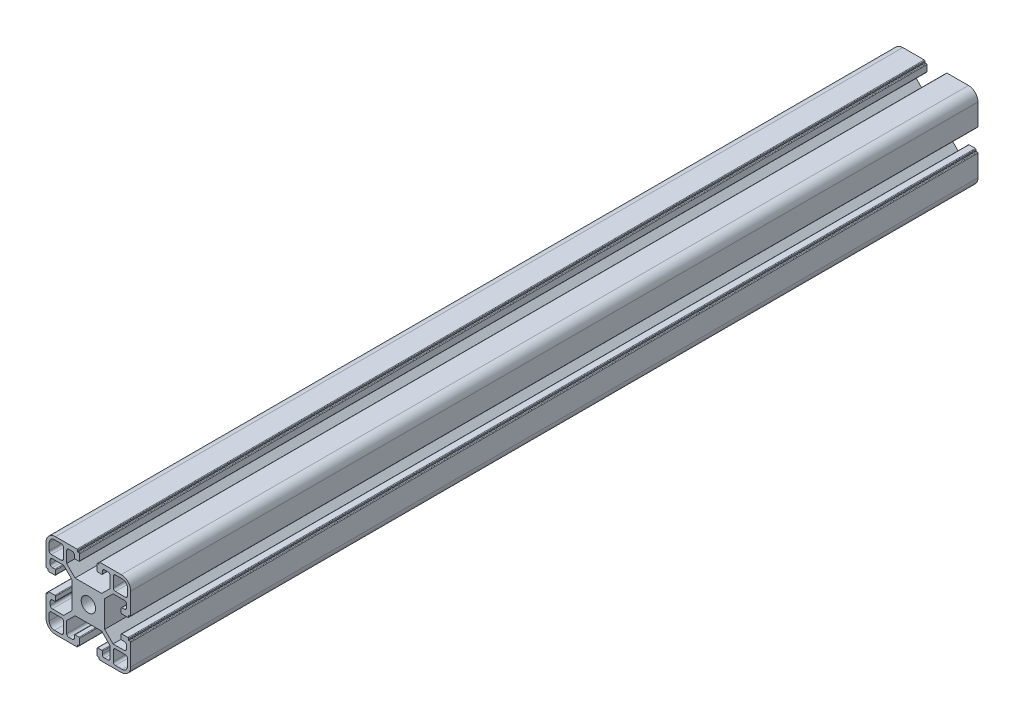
SolidWorks part; units mm, degrees
ref_plane "Plan de face" through (0, 0, 0) normal (0, 0, 1) x (1, 0, 0)
ref_plane "Plan de dessus" through (0, 0, 0) normal (0, 1, 0) x (1, 0, 0)
ref_plane "Plan de droite" through (0, 0, 0) normal (1, 0, 0) x (0, 0, -1)
sketch "Esquisse1" plane through (0, 0, 0) normal (0, 0, 1) x (1, 0, 0)
  line L0 (-4.2483, 11.6297) -> (-8.9983, 11.6297)
  line L1 (-9.9983, 12.6297) -> (-9.9983, 15.8797)
  line L2 (-7.4983, 18.3797) -> (-4.2483, 18.3797)
  line L3 (-3.2483, 17.3797) -> (-3.2483, 12.6297)
  line L4 (21.2517, -11.8703) -> (26.0017, -11.8703)
  line L5 (27.0017, -12.8703) -> (27.0017, -16.1203)
  line L6 (24.5017, -18.6203) -> (21.2517, -18.6203)
  line L7 (20.2517, -17.6203) -> (20.2517, -12.8703)
  line L8 (-3.2483, -12.8703) -> (-3.2483, -17.6203)
  line L9 (-4.2483, -18.6203) -> (-7.4983, -18.6203)
  line L10 (-9.9983, -16.1203) -> (-9.9983, -12.8703)
  line L11 (-8.9983, -11.8703) -> (-4.2483, -11.8703)
  line L12 (27.0017, 15.8797) -> (27.0017, 12.6297)
  line L13 (26.0017, 11.6297) -> (21.2553, 11.6297)
  line L14 (20.2517, 12.6297) -> (20.2517, 17.3797)
  line L15 (21.2517, 18.3797) -> (24.5017, 18.3797)
  line L16 (0.8017, -6.4061) -> (0.8017, 6.1654)
  line L17 (0.8017, -6.4061) -> (-3.1625, -10.3703)
  line L18 (-8.4983, -10.3703) -> (-3.1625, -10.3703)
  line L19 (-9.4983, -7.7203) -> (-9.4983, -9.3703)
  line L20 (-8.4983, -6.7203) -> (-7.2983, -6.7203)
  line L21 (-6.9983, -4.5203) -> (-6.9983, -6.4203)
  line L22 (-10.1983, -4.2203) -> (-7.2983, -4.2203)
  line L23 (-10.4983, -4.5203) -> (-10.4983, -5.0203)
  line L24 (-11.1983, -5.2203) -> (-10.6983, -5.2203)
  line L25 (-11.4983, -5.5203) -> (-11.4983, -15.6203)
  line L26 (-6.9983, -20.1203) -> (3.1017, -20.1203)
  line L27 (3.4017, -19.8203) -> (3.4017, -19.3203)
  line L28 (3.6017, -19.1203) -> (4.1017, -19.1203)
  line L29 (4.4017, -18.8203) -> (4.4017, -15.9203)
  line L30 (2.2017, -15.6203) -> (4.1017, -15.6203)
  line L31 (1.9017, -17.1203) -> (1.9017, -15.9203)
  line L32 (-0.7483, -18.1203) -> (0.9017, -18.1203)
  line L33 (-1.7483, -17.1203) -> (-1.7483, -11.7846)
  line L34 (2.2159, -7.8203) -> (-1.7483, -11.7846)
  line L35 (14.7875, -7.8203) -> (2.2159, -7.8203)
  line L36 (14.7875, -7.8203) -> (18.7517, -11.7846)
  line L37 (18.7517, -17.1203) -> (18.7517, -11.7846)
  line L38 (16.1017, -18.1203) -> (17.7517, -18.1203)
  line L39 (15.1017, -17.1203) -> (15.1017, -15.9203)
  line L40 (12.9017, -15.6203) -> (14.8017, -15.6203)
  line L41 (12.6017, -18.8203) -> (12.6017, -15.9203)
  line L42 (12.9017, -19.1203) -> (13.4017, -19.1203)
  line L43 (13.6017, -19.8203) -> (13.6017, -19.3203)
  line L44 (13.9017, -20.1203) -> (24.0017, -20.1203)
  line L45 (28.5017, -15.6203) -> (28.5017, -5.5203)
  line L46 (28.2017, -5.2203) -> (27.7017, -5.2203)
  line L47 (27.5017, -5.0203) -> (27.5017, -4.5203)
  line L48 (27.2017, -4.2203) -> (24.3017, -4.2203)
  line L49 (24.0017, -6.4203) -> (24.0017, -4.5203)
  line L50 (25.5017, -6.7203) -> (24.3017, -6.7203)
  line L51 (26.5017, -9.3703) -> (26.5017, -7.7203)
  line L52 (25.5017, -10.3703) -> (20.1659, -10.3703)
  line L53 (16.2017, -6.4061) -> (20.1659, -10.3703)
  line L54 (16.2017, 6.1654) -> (16.2017, -6.4061)
  line L55 (16.2017, 6.1654) -> (20.1659, 10.1297)
  line L56 (25.5017, 10.1297) -> (20.1659, 10.1297)
  line L57 (26.5017, 7.4797) -> (26.5017, 9.1297)
  line L58 (25.5017, 6.4797) -> (24.3017, 6.4797)
  line L59 (24.0017, 4.2797) -> (24.0017, 6.1797)
  line L60 (27.2017, 3.9797) -> (24.3017, 3.9797)
  line L61 (27.5017, 4.2797) -> (27.5017, 4.7797)
  line L62 (28.2017, 4.9797) -> (27.7017, 4.9797)
  line L63 (28.5017, 5.2797) -> (28.5017, 15.3797)
  line L64 (24.0017, 19.8797) -> (13.9017, 19.8797)
  line L65 (13.6017, 19.5797) -> (13.6017, 19.0797)
  line L66 (13.4017, 18.8797) -> (12.9017, 18.8797)
  line L67 (12.6017, 18.5797) -> (12.6017, 15.6797)
  line L68 (14.8017, 15.3797) -> (12.9017, 15.3797)
  line L69 (15.1017, 16.8797) -> (15.1017, 15.6797)
  line L70 (17.7517, 17.8797) -> (16.1017, 17.8797)
  line L71 (18.7517, 16.8797) -> (18.7517, 11.5439)
  line L72 (14.7875, 7.5797) -> (18.7517, 11.5439)
  line L73 (2.2159, 7.5797) -> (14.7875, 7.5797)
  line L74 (2.2159, 7.5797) -> (-1.7483, 11.5439)
  line L75 (-1.7483, 16.8797) -> (-1.7483, 11.5439)
  line L76 (0.9017, 17.8797) -> (-0.7483, 17.8797)
  line L77 (1.9017, 16.8797) -> (1.9017, 15.6797)
  line L78 (4.1017, 15.3797) -> (2.2017, 15.3797)
  line L79 (4.4017, 18.5797) -> (4.4017, 15.6797)
  line L80 (4.1017, 18.8797) -> (3.6017, 18.8797)
  line L81 (3.4017, 19.5797) -> (3.4017, 19.0797)
  line L82 (3.1017, 19.8797) -> (-6.9983, 19.8797)
  line L83 (-11.4983, 15.3797) -> (-11.4983, 5.2797)
  line L84 (-11.1983, 4.9797) -> (-10.6983, 4.9797)
  line L85 (-10.4983, 4.7797) -> (-10.4983, 4.2797)
  line L86 (-10.1983, 3.9797) -> (-7.2983, 3.9797)
  line L87 (-6.9983, 6.1797) -> (-6.9983, 4.2797)
  line L88 (-8.4983, 6.4797) -> (-7.2983, 6.4797)
  line L89 (-9.4983, 9.1297) -> (-9.4983, 7.4797)
  line L90 (-8.4983, 10.1297) -> (-3.1625, 10.1297)
  line L91 (0.8017, 6.1654) -> (-3.1625, 10.1297)
  line L92 (21.2553, 11.6297) -> (21.2517, 11.6297)
  arc A0 (-4.2483, 11.6297) -> (-3.2483, 12.6297) centre (-4.2483, 12.6297) ccw
  arc A1 (-9.9983, 12.6297) -> (-8.9983, 11.6297) centre (-8.9983, 12.6297) ccw
  arc A2 (-7.4983, 18.3797) -> (-9.9983, 15.8797) centre (-7.4983, 15.8797) ccw
  arc A3 (-3.2483, 17.3797) -> (-4.2483, 18.3797) centre (-4.2483, 17.3797) ccw
  arc A4 (21.2517, -11.8703) -> (20.2517, -12.8703) centre (21.2517, -12.8703) ccw
  arc A5 (27.0017, -12.8703) -> (26.0017, -11.8703) centre (26.0017, -12.8703) ccw
  arc A6 (24.5017, -18.6203) -> (27.0017, -16.1203) centre (24.5017, -16.1203) ccw
  arc A7 (20.2517, -17.6203) -> (21.2517, -18.6203) centre (21.2517, -17.6203) ccw
  arc A8 (-3.2483, -12.8703) -> (-4.2483, -11.8703) centre (-4.2483, -12.8703) ccw
  arc A9 (-4.2483, -18.6203) -> (-3.2483, -17.6203) centre (-4.2483, -17.6203) ccw
  arc A10 (-9.9983, -16.1203) -> (-7.4983, -18.6203) centre (-7.4983, -16.1203) ccw
  arc A11 (-8.9983, -11.8703) -> (-9.9983, -12.8703) centre (-8.9983, -12.8703) ccw
  circle A12 centre (8.5017, -0.1203) radius 3.4
  arc A13 (27.0017, 15.8797) -> (24.5017, 18.3797) centre (24.5017, 15.8797) ccw
  arc A14 (26.0017, 11.6297) -> (27.0017, 12.6297) centre (26.0017, 12.6297) ccw
  arc A15 (20.2517, 12.6297) -> (21.2517, 11.6297) centre (21.2517, 12.6297) ccw
  arc A16 (21.2517, 18.3797) -> (20.2517, 17.3797) centre (21.2517, 17.3797) ccw
  arc A17 (-9.4983, -9.3703) -> (-8.4983, -10.3703) centre (-8.4983, -9.3703) ccw
  arc A18 (-8.4983, -6.7203) -> (-9.4983, -7.7203) centre (-8.4983, -7.7203) ccw
  arc A19 (-7.2983, -6.7203) -> (-6.9983, -6.4203) centre (-7.2983, -6.4203) ccw
  arc A20 (-6.9983, -4.5203) -> (-7.2983, -4.2203) centre (-7.2983, -4.5203) ccw
  arc A21 (-10.1983, -4.2203) -> (-10.4983, -4.5203) centre (-10.1983, -4.5203) ccw
  arc A22 (-10.6983, -5.2203) -> (-10.4983, -5.0203) centre (-10.6983, -5.0203) ccw
  arc A23 (-11.1983, -5.2203) -> (-11.4983, -5.5203) centre (-11.1983, -5.5203) ccw
  arc A24 (-11.4983, -15.6203) -> (-6.9983, -20.1203) centre (-6.9983, -15.6203) ccw
  arc A25 (3.1017, -20.1203) -> (3.4017, -19.8203) centre (3.1017, -19.8203) ccw
  arc A26 (3.6017, -19.1203) -> (3.4017, -19.3203) centre (3.6017, -19.3203) ccw
  arc A27 (4.1017, -19.1203) -> (4.4017, -18.8203) centre (4.1017, -18.8203) ccw
  arc A28 (4.4017, -15.9203) -> (4.1017, -15.6203) centre (4.1017, -15.9203) ccw
  arc A29 (2.2017, -15.6203) -> (1.9017, -15.9203) centre (2.2017, -15.9203) ccw
  arc A30 (0.9017, -18.1203) -> (1.9017, -17.1203) centre (0.9017, -17.1203) ccw
  arc A31 (-1.7483, -17.1203) -> (-0.7483, -18.1203) centre (-0.7483, -17.1203) ccw
  arc A32 (17.7517, -18.1203) -> (18.7517, -17.1203) centre (17.7517, -17.1203) ccw
  arc A33 (15.1017, -17.1203) -> (16.1017, -18.1203) centre (16.1017, -17.1203) ccw
  arc A34 (15.1017, -15.9203) -> (14.8017, -15.6203) centre (14.8017, -15.9203) ccw
  arc A35 (12.9017, -15.6203) -> (12.6017, -15.9203) centre (12.9017, -15.9203) ccw
  arc A36 (12.6017, -18.8203) -> (12.9017, -19.1203) centre (12.9017, -18.8203) ccw
  arc A37 (13.6017, -19.3203) -> (13.4017, -19.1203) centre (13.4017, -19.3203) ccw
  arc A38 (13.6017, -19.8203) -> (13.9017, -20.1203) centre (13.9017, -19.8203) ccw
  arc A39 (24.0017, -20.1203) -> (28.5017, -15.6203) centre (24.0017, -15.6203) ccw
  arc A40 (28.5017, -5.5203) -> (28.2017, -5.2203) centre (28.2017, -5.5203) ccw
  arc A41 (27.5017, -5.0203) -> (27.7017, -5.2203) centre (27.7017, -5.0203) ccw
  arc A42 (27.5017, -4.5203) -> (27.2017, -4.2203) centre (27.2017, -4.5203) ccw
  arc A43 (24.3017, -4.2203) -> (24.0017, -4.5203) centre (24.3017, -4.5203) ccw
  arc A44 (24.0017, -6.4203) -> (24.3017, -6.7203) centre (24.3017, -6.4203) ccw
  arc A45 (26.5017, -7.7203) -> (25.5017, -6.7203) centre (25.5017, -7.7203) ccw
  arc A46 (25.5017, -10.3703) -> (26.5017, -9.3703) centre (25.5017, -9.3703) ccw
  arc A47 (26.5017, 9.1297) -> (25.5017, 10.1297) centre (25.5017, 9.1297) ccw
  arc A48 (25.5017, 6.4797) -> (26.5017, 7.4797) centre (25.5017, 7.4797) ccw
  arc A49 (24.3017, 6.4797) -> (24.0017, 6.1797) centre (24.3017, 6.1797) ccw
  arc A50 (24.0017, 4.2797) -> (24.3017, 3.9797) centre (24.3017, 4.2797) ccw
  arc A51 (27.2017, 3.9797) -> (27.5017, 4.2797) centre (27.2017, 4.2797) ccw
  arc A52 (27.7017, 4.9797) -> (27.5017, 4.7797) centre (27.7017, 4.7797) ccw
  arc A53 (28.2017, 4.9797) -> (28.5017, 5.2797) centre (28.2017, 5.2797) ccw
  arc A54 (28.5017, 15.3797) -> (24.0017, 19.8797) centre (24.0017, 15.3797) ccw
  arc A55 (13.9017, 19.8797) -> (13.6017, 19.5797) centre (13.9017, 19.5797) ccw
  arc A56 (13.4017, 18.8797) -> (13.6017, 19.0797) centre (13.4017, 19.0797) ccw
  arc A57 (12.9017, 18.8797) -> (12.6017, 18.5797) centre (12.9017, 18.5797) ccw
  arc A58 (12.6017, 15.6797) -> (12.9017, 15.3797) centre (12.9017, 15.6797) ccw
  arc A59 (14.8017, 15.3797) -> (15.1017, 15.6797) centre (14.8017, 15.6797) ccw
  arc A60 (16.1017, 17.8797) -> (15.1017, 16.8797) centre (16.1017, 16.8797) ccw
  arc A61 (18.7517, 16.8797) -> (17.7517, 17.8797) centre (17.7517, 16.8797) ccw
  arc A62 (-0.7483, 17.8797) -> (-1.7483, 16.8797) centre (-0.7483, 16.8797) ccw
  arc A63 (1.9017, 16.8797) -> (0.9017, 17.8797) centre (0.9017, 16.8797) ccw
  arc A64 (1.9017, 15.6797) -> (2.2017, 15.3797) centre (2.2017, 15.6797) ccw
  arc A65 (4.1017, 15.3797) -> (4.4017, 15.6797) centre (4.1017, 15.6797) ccw
  arc A66 (4.4017, 18.5797) -> (4.1017, 18.8797) centre (4.1017, 18.5797) ccw
  arc A67 (3.4017, 19.0797) -> (3.6017, 18.8797) centre (3.6017, 19.0797) ccw
  arc A68 (3.4017, 19.5797) -> (3.1017, 19.8797) centre (3.1017, 19.5797) ccw
  arc A69 (-6.9983, 19.8797) -> (-11.4983, 15.3797) centre (-6.9983, 15.3797) ccw
  arc A70 (-11.4983, 5.2797) -> (-11.1983, 4.9797) centre (-11.1983, 5.2797) ccw
  arc A71 (-10.4983, 4.7797) -> (-10.6983, 4.9797) centre (-10.6983, 4.7797) ccw
  arc A72 (-10.4983, 4.2797) -> (-10.1983, 3.9797) centre (-10.1983, 4.2797) ccw
  arc A73 (-7.2983, 3.9797) -> (-6.9983, 4.2797) centre (-7.2983, 4.2797) ccw
  arc A74 (-6.9983, 6.1797) -> (-7.2983, 6.4797) centre (-7.2983, 6.1797) ccw
  arc A75 (-9.4983, 7.4797) -> (-8.4983, 6.4797) centre (-8.4983, 7.4797) ccw
  arc A76 (-8.4983, 10.1297) -> (-9.4983, 9.1297) centre (-8.4983, 9.1297) ccw
extrude "Extrusion1" add sketch "Esquisse1" along normal blind 400
